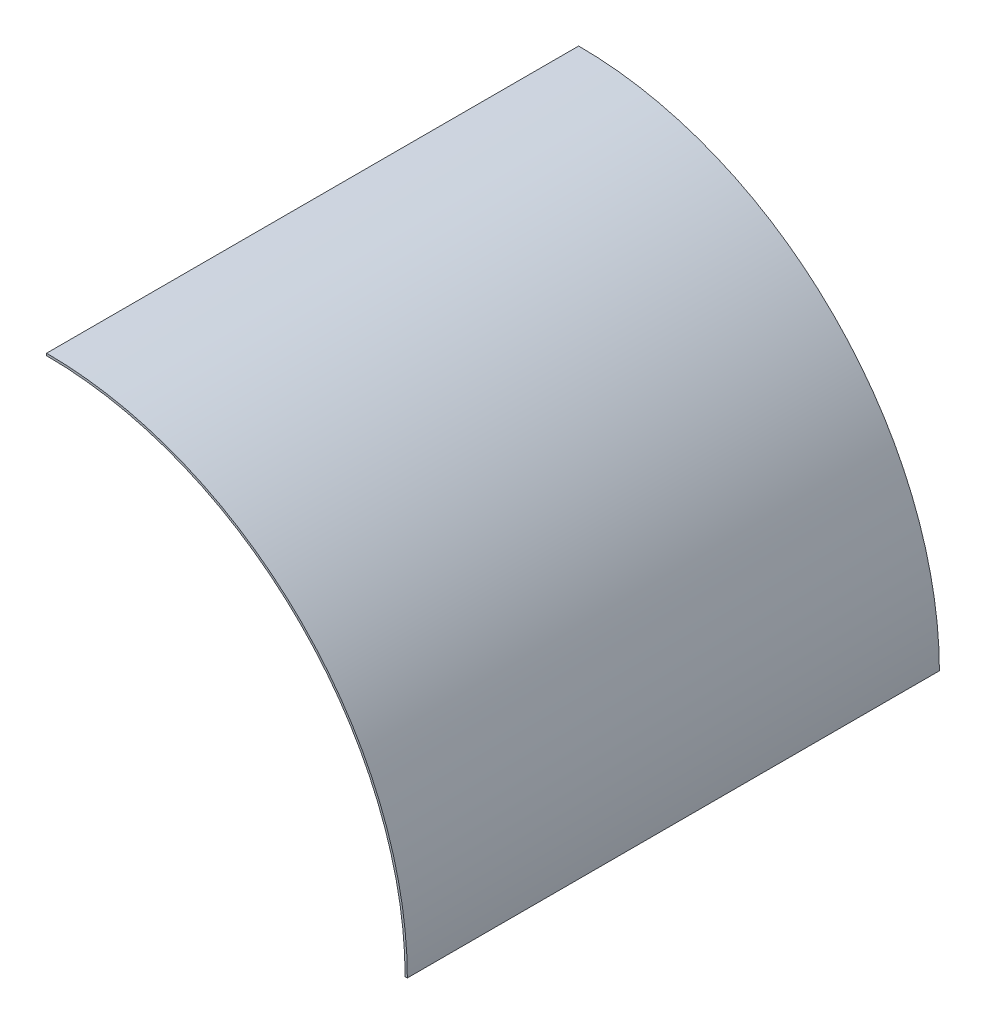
SolidWorks part; units mm, degrees
ref_plane "Front Plane" through (0, 0, 0) normal (0, 0, 1) x (1, 0, 0)
ref_plane "Top Plane" through (0, 0, 0) normal (0, 1, 0) x (1, 0, 0)
ref_plane "Right Plane" through (0, 0, 0) normal (1, 0, 0) x (0, 0, -1)
sketch "Sketch1" plane through (0, 0, 0) normal (0, 0, 1) x (1, 0, 0)
  line L0 (0, 0) -> (0, 45.174) construction
  line L1 (0, 0) -> (40.8023, 0) construction
  line L2 (0, 2034) -> (0, 2021.5)
  line L3 (2034, 0) -> (2021.5, 0)
  arc A0 (0, 2021.5) -> (2021.5, 0) centre (0, 0) cw
  arc A1 (0, 2034) -> (2034, 0) centre (0, 0) cw
  dimension "D1" = 2021.5
  dimension "D2" = 12.5
extrude "Boss-Extrude1" add sketch "Sketch1" against normal blind 3000
